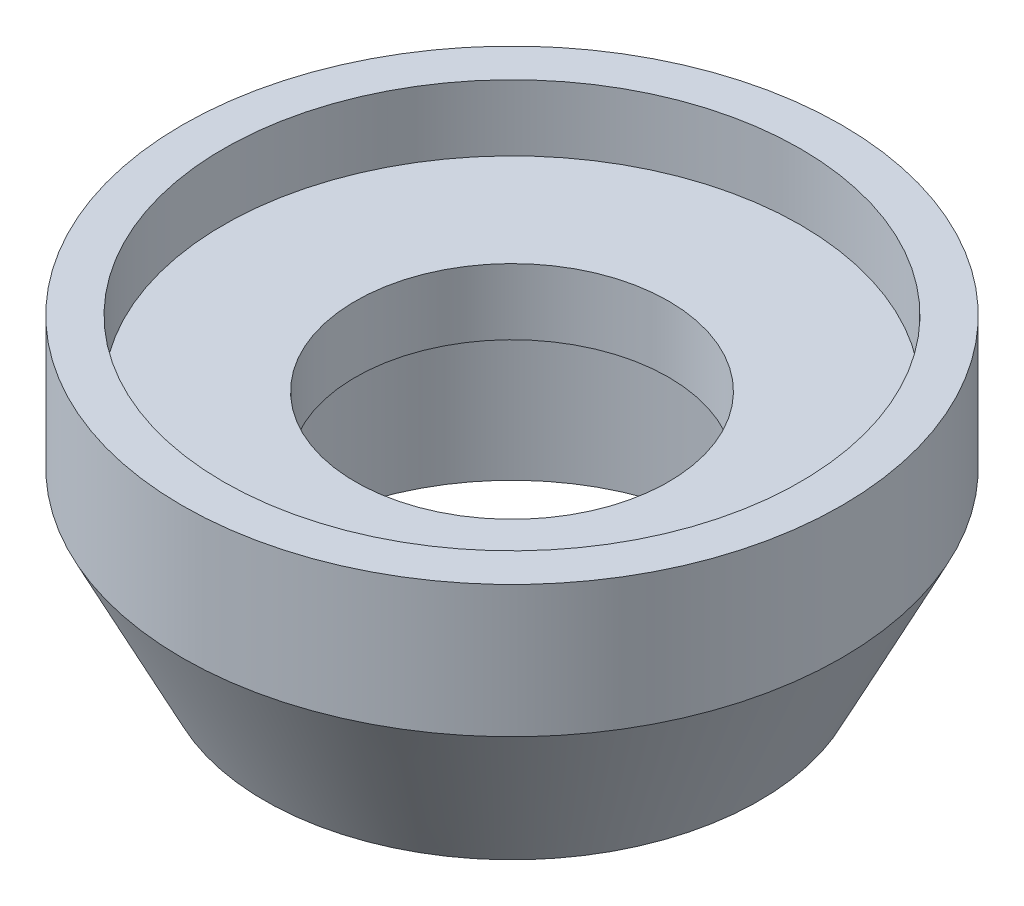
SolidWorks part; units mm, degrees
ref_plane "Plan de face" through (0, 0, 0) normal (0, 0, 1) x (1, 0, 0)
ref_plane "Plan de dessus" through (0, 0, 0) normal (0, 1, 0) x (1, 0, 0)
ref_plane "Plan de droite" through (0, 0, 0) normal (1, 0, 0) x (0, 0, -1)
sketch "Esquisse1" plane through (0, 0, 0) normal (0, 0, 1) x (1, 0, 0)
  line L0 (0, 0) -> (0, 36.0555) construction
  line L1 (-13.2, 7.677) -> (-13.2, 17.677)
  line L2 (-13.2, 17.677) -> (-9.5, 17.677)
  line L3 (-9.5, 17.677) -> (-9.5, 21.677)
  line L4 (-9.5, 21.677) -> (-17.5, 21.677)
  line L5 (-17.5, 21.677) -> (-17.5, 25.677)
  line L6 (-17.5, 25.677) -> (-20, 25.677)
  line L7 (-20, 25.677) -> (-20, 17.677)
  line L8 (-20, 17.677) -> (-15, 7.677)
  line L9 (-15, 7.677) -> (-13.2, 7.677)
  dimension "D1" = 26.4
  dimension "D2" = 19
  dimension "D3" = 4
  dimension "D4" = 40
  dimension "D5" = 35
  dimension "D6" = 10
  dimension "D7" = 4
  dimension "D8" = 30
  dimension "D9" = 10
revolve "Révolution2" add sketch "Esquisse1" angle 360 about L0
